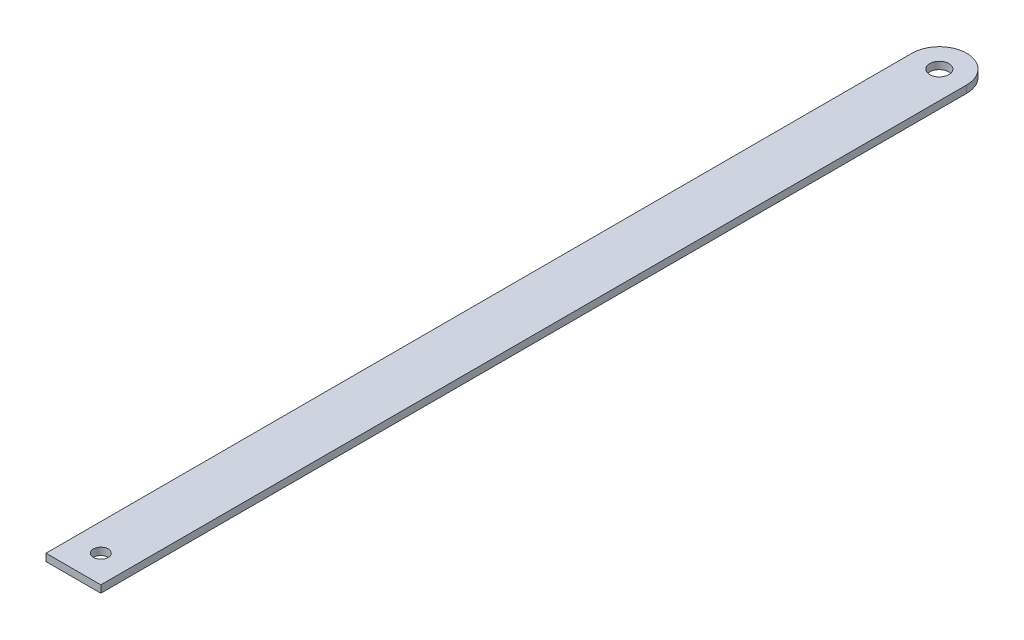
SolidWorks part; units mm, degrees
ref_plane "Piano frontale" through (0, 0, 0) normal (0, 0, 1) x (1, 0, 0)
ref_plane "Piano superiore" through (0, 0, 0) normal (0, 1, 0) x (1, 0, 0)
ref_plane "Piano destro" through (0, 0, 0) normal (1, 0, 0) x (0, 0, -1)
sketch "Schizzo1" plane through (0, 0, 0) normal (0, 1, 0) x (1, 0, 0)
  line L0 (1126.6351, 1873.526) -> (1126.6351, 1399.6085)
  line L1 (1156.6351, 1873.526) -> (1156.6351, 1399.6085)
  line L2 (1126.6351, 1399.6085) -> (1156.6351, 1399.6085)
  circle A0 centre (1141.6351, 1873.526) radius 5.25
  arc A1 (1156.6351, 1873.526) -> (1126.6351, 1873.526) centre (1141.6351, 1873.526) ccw
  circle A2 centre (1141.6351, 1414.6085) radius 4.05
extrude "Estrusione-Estrusione1" add sketch "Schizzo1" along normal blind 4
move or copy body "Corpo-Sposta/copia1" [suppressed] bodies to move or copy 101
